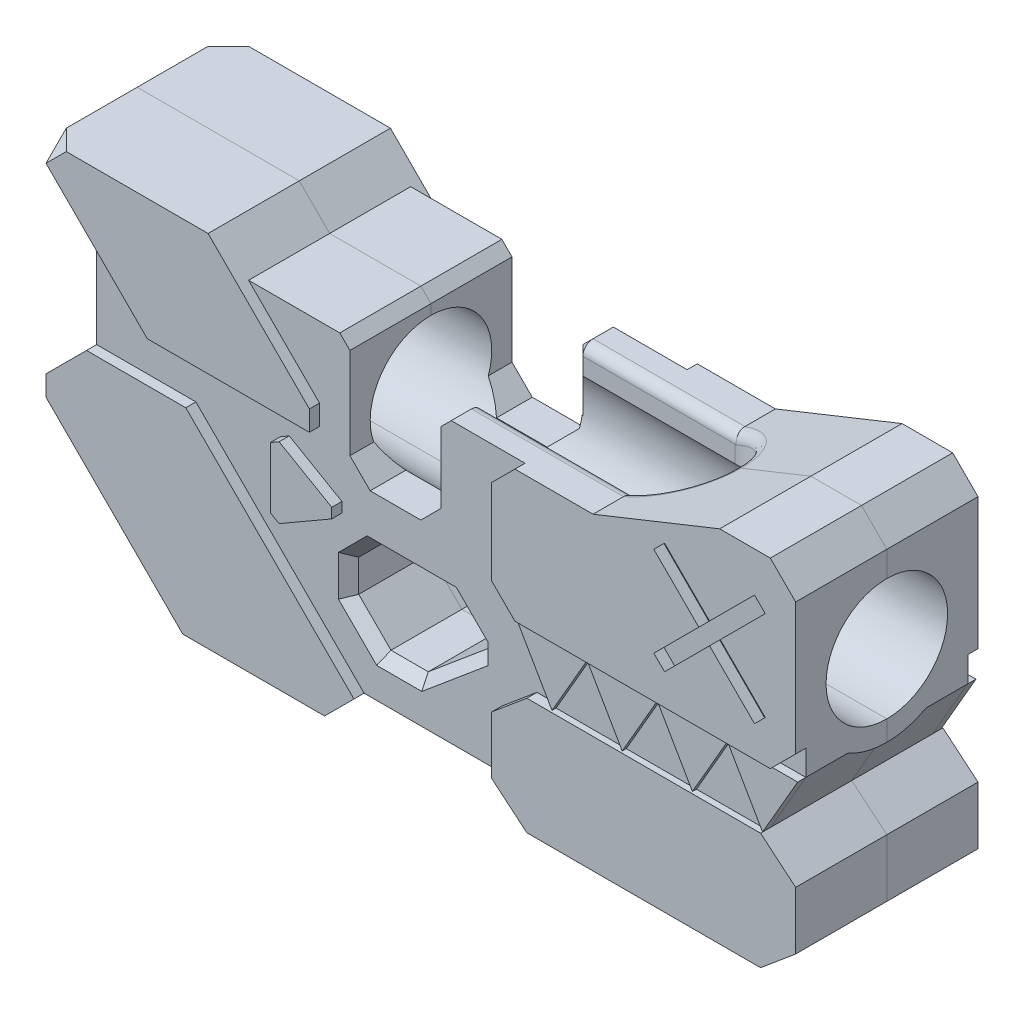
SolidWorks part; units mm, degrees
other "Left Body"
other "Right Body" parameters "D28"=1, "D29"=1, "D30"=1
ref_plane "Front Plane" through (0, 0, 0) normal (0, 0, 1) x (1, 0, 0)
ref_plane "Top Plane" through (0, 0, 0) normal (0, 1, 0) x (1, 0, 0)
ref_plane "Right Plane" through (0, 0, 0) normal (1, 0, 0) x (0, 0, -1)
sketch "Sketch1" plane through (0, 0, 0) normal (0, 0, 1) x (1, 0, 0)
  line L0 (0, -20.2192) -> (0, 20.2192) construction
  line L1 (-50.0725, 0) -> (50.0725, 0) construction
  line L2 (0, 6) -> (45, 6)
  line L3 (45, 6) -> (45, -6)
  line L4 (45, -6) -> (0, -6)
  line L5 (0, -6) -> (0, 6)
  line L6 (-25, 6) -> (0, 6)
  line L7 (-25, 6) -> (-25, -6)
  line L8 (-25, -6) -> (0, -6)
  line L9 (-20, 5.5) -> (0, 5.5)
  line L10 (-20, 5.5) -> (-20, -5.5)
  line L11 (-20, -5.5) -> (0, -5.5)
  line L12 (0, -5.5) -> (20, -5.5)
  line L13 (40, -5.5) -> (40, 5.5) construction
  line L14 (20, 5.5) -> (0, 5.5)
  line L15 (20, 5.5) -> (20, -5.5)
  line L16 (-25, 8) -> (45, 8)
  line L17 (20, 5.5) -> (40, 5.5) construction
  line L18 (-25, -8) -> (45, -8)
  line L19 (20, -5.5) -> (40, -5.5) construction
  line L22 (30, 0) -> (30, 8) construction
  line L23 (-10, 8) -> (-10, -8) construction
  line L24 (-5, 8) -> (-5, -8) construction
  line L25 (-13.5555, -24.5) -> (-1.5, -24.5) construction
  line L26 (-10.5555, -8) -> (-10.5555, -23)
  line L27 (-4.5, -8) -> (-4.5, -23)
  line L28 (-4.5, -23) -> (-10.5555, -23)
  circle A0 centre (5, 0) radius 4
  circle A1 centre (25, 0) radius 4 construction
  circle A2 centre (5, 0) radius 5
  circle A3 centre (25, 0) radius 5
  point P4 (0, 0)
  point P8 (0, 0)
  point P11 (45, 0)
  point P21 (-20, 0)
  dimension "D3" = 8
  dimension "D5" = 8
  dimension "D14" = 1
  dimension "D15" = 1
  dimension "D1" = 11
  dimension "D2" = 12
  dimension "D4" = 5
  dimension "D6" = 20
  dimension "D7" = 15
  dimension "D8" = 2
  dimension "D9" = 25
  dimension "D10" = 2
  dimension "D11" = 5
  dimension "D12" = 15
  dimension "D13" = 5
  dimension "D16" = 10
  dimension "D17" = 5
  dimension "D18" = 15
  dimension "D19" = 0.5555
  dimension "D20" = 0.5
  dimension "D21" = 1.5
  dimension "D22" = 3
  dimension "D23" = 3
sketch "Sketch2" plane through (0, 0, 0) normal (1, 0, 0) x (0, 0, -1)
  line L1 (-8, -8) -> (8, -8)
  line L2 (-8, -8) -> (-8, 8)
  line L3 (-8, 8) -> (8, 8)
  line L4 (8, -8) -> (8, 8)
  line L5 (0, 8) -> (0, -8) construction
  line L6 (-8, 0) -> (8, 0) construction
  circle A0 centre (0, 0) radius 6
  circle A1 centre (0, 0) radius 8
  dimension "D1" = 12
  dimension "D2" = 2
extrude "Boss-Extrude1" add sketch "Sketch2" against normal blind 25 contours A1 L4 L3 | A1 L3 L2 | A1 L2 L1 | A1 L1 L4 | A1 A0
sketch "Sketch3" plane through (0, 0, 0) normal (1, 0, 0) x (0, 0, -1)
  line L4 (8, 8) -> (-8, 8)
  line L5 (-8, 8) -> (-8, -8)
  line L6 (-8, -8) -> (8, -8)
  line L7 (8, -8) -> (8, 8)
  line L8 (8, 8) -> (-8, 8)
  line L9 (-8, 8) -> (-8, -8)
  line L10 (-8, -8) -> (8, -8)
  line L11 (8, -8) -> (8, 8)
  dimension "D1" = 0
extrude "Boss-Extrude2" add sketch "Sketch3" along normal blind 45 contours M8 M5 M6 M7 M9
sketch "Sketch4" plane through (0, 8, 0) normal (0, 1, 0) x (1, 0, 0)
  line L0 (-51.1534, 0) -> (51.1534, 0) construction
  line L1 (5, 5) -> (25, 5)
  line L3 (5, -5) -> (25, -5)
  circle A0 centre (5, 0) radius 5
  circle A1 centre (25, 0) radius 5
  point P12 (0, 0)
  dimension "D1" = 10
  dimension "D2" = 5
  dimension "D3" = 20
extrude "Cut-Extrude1" cut sketch "Sketch4" against normal blind 10 contours A0 L0 | L0 A0 | L0 A0 L3 A1 | A0 L0 A1 L1 | A1 L0 | L0 A1
sketch "Sketch6" plane through (0, 0, 8) normal (0, 0, 1) x (1, 0, 0)
  line L0 (0, 8) -> (5, 6)
  line L1 (-25, 8) -> (45, 8) construction
  line L2 (0, 8) -> (30, 8)
  line L3 (30, 8) -> (25, 6)
  line L6 (5, 6) -> (25, 6)
  line L9 (0, 6) -> (45, 6) construction
  line L12 (5, 0) -> (5, 10.0235) construction
  line L13 (25, 0) -> (25, 10.3915) construction
extrude "Cut-Extrude5" cut sketch "Sketch6" against normal through all contours L0 L6 L3 L2
sketch "Sketch8" plane through (0, 0, 8) normal (0, 0, 1) x (1, 0, 0)
  line L0 (0, 0) -> (0, 8)
  line L1 (9, 0) -> (9, 6)
  line L2 (0, 6) -> (45, 6) construction
  line L3 (9, 6) -> (0, 8)
  line L5 (0, -6) -> (0, 6) construction
  line L6 (-50.0725, 0) -> (50.0725, 0) construction
  line L7 (0, 0) -> (0, -4)
  line L8 (0, -4) -> (9, -4)
  line L9 (9, -4) -> (9, 0)
  circle A0 centre (5, 0) radius 5 construction
  circle A1 centre (5, 0) radius 4 construction
extrude "Cut-Extrude7" cut sketch "Sketch8" against normal blind 8
chamfer "Chamfer2" distance 2 angle 45 2 edges at (9, -4, 6.2361) (0, -4, 6.2361)
chamfer "Chamfer1" distance 1 angle 45 1 edges at (9, 6, 6.5)
sketch "Sketch9" plane through (0, 0, 8) normal (0, 0, 1) x (1, 0, 0)
  line L0 (45, 8.5) -> (45, -7)
  line L2 (-25, -8) -> (-25, 8)
  line L6 (0, 6) -> (45, 6) construction
  line L9 (-25, 8) -> (-28, 8)
  line L10 (-28, 8) -> (-28, -8)
  line L11 (-28, -8) -> (-25, -8)
  line L12 (-29, 9) -> (-25, 5)
  line L13 (-25, 5) -> (-25, -5)
  line L14 (-25, -5) -> (-29, -9)
  line L15 (-29, 9) -> (-29, 11)
  line L16 (-29, 11) -> (-13, 11)
  line L17 (-13, 11) -> (-3, 1)
  line L18 (-3, 1) -> (-3, -1)
  line L19 (-3, -1) -> (-19, -1)
  line L20 (-19, -1) -> (-25, 5)
  line L21 (-29, -9) -> (-29, -11)
  line L22 (-29, -11) -> (-15.5, -24.5)
  line L23 (-15.5, -24.5) -> (-1.5, -24.5)
  line L24 (-13.5555, -24.5) -> (-1.5, -24.5) construction
  line L25 (-25, -5) -> (-15.201, -5)
  line L26 (-15.201, -5) -> (1.3995, -21.6005)
  line L27 (1.3995, -21.6005) -> (-1.5, -24.5)
  line L28 (1.6985, -8) -> (10.509, -8)
  line L29 (-25, -8) -> (45, -8) construction
  line L30 (10.509, -8) -> (13.6371, -11.1281)
  line L31 (13.6371, -13.1281) -> (7.099, -18.6005)
  line L32 (7.099, -18.6005) -> (2.6421, -18.6005)
  line L33 (2.6421, -18.6005) -> (-1.1299, -14.8284)
  line L34 (-1.1299, -14.8284) -> (-1.1299, -10.8284)
  line L35 (-1.1299, -10.8284) -> (1.6985, -8)
  line L36 (17.2872, 6) -> (15, 3.7128)
  line L37 (15, 3.7128) -> (15, -4.7128)
  line L38 (15, -4.7128) -> (17.2872, -7)
  line L39 (17.2872, -7) -> (45, -7)
  line L40 (42.5, -7) -> (45, -4.5)
  line L42 (45, 8.5) -> (42.5, 11)
  line L43 (42.5, 11) -> (37.5, 11)
  line L45 (18.4641, -13) -> (15, -15.8995)
  line L46 (15, -15.8995) -> (15, -21.6005)
  line L47 (15, -21.6005) -> (18.4641, -24.5)
  line L48 (18.4641, -24.5) -> (41.5359, -24.5)
  line L49 (41.5359, -24.5) -> (45, -21.6005)
  line L50 (45, -21.6005) -> (45, -15.8995)
  line L51 (45, -15.8995) -> (41.5359, -13)
  line L52 (41.5359, -13) -> (18.4641, -13)
  line L53 (1.3995, -21.6005) -> (15, -21.6005)
  line L59 (-6.8554, -3.8) -> (-5.9894, -3.3)
  line L61 (45, -7) -> (41.5359, -13)
  line L62 (38.0718, -7) -> (41.5359, -13)
  line L63 (45, 8) -> (45, -8) construction
  line L64 (34.6077, -13) -> (31.1436, -7)
  line L76 (38.0718, -7) -> (34.6077, -13)
  line L77 (31.1436, -7) -> (27.6795, -13)
  line L78 (27.6795, -13) -> (24.2154, -7)
  line L79 (24.2154, -7) -> (20.7513, -13)
  line L80 (20.7513, -13) -> (17.2872, -7)
  line L81 (15, -15.8995) -> (45, -15.8995) construction
  line L82 (41.5359, -13) -> (41.5359, -24.5) construction
  line L84 (13.6371, -11.1281) -> (13.6371, -13.1281)
  line L85 (-6.8554, -2.8) -> (-6.8554, -10.8)
  line L86 (-6.8554, -10.8) -> (0.0728, -6.8)
  line L87 (0.0728, -6.8) -> (-6.8554, -2.8)
  line L88 (25, 6) -> (37.5, 11)
  line L89 (-6.8554, -9.8) -> (-5.9894, -10.3)
  line L90 (-25, 8) -> (45, 8) construction
  line L91 (30, 8) -> (25, 6) construction
  line L92 (-0.7932, -7.3) -> (-0.7932, -6.3)
  line L93 (17.2872, 6) -> (25, 6)
  line L94 (31, 6) -> (40.9393, -3.9393)
  line L95 (31, 7.0607) -> (42, 7.0607)
  line L96 (31, 7.0607) -> (31, -3.9393)
  line L97 (31, -3.9393) -> (42, -3.9393)
  line L98 (42, 7.0607) -> (42, -3.9393)
  line L99 (36.5, -3.9393) -> (36.5, 7.0607) construction
  line L100 (31, 1.5607) -> (42, 1.5607) construction
  line L101 (40.9393, -3.9393) -> (42, -2.8787)
  line L102 (42, -2.8787) -> (32.0607, 7.0607)
  line L103 (32.0607, 7.0607) -> (31, 6)
  line L104 (31, -2.8787) -> (32.0607, -3.9393)
  line L105 (32.0607, -3.9393) -> (42, 6)
  line L106 (42, 6) -> (40.9393, 7.0607)
  line L107 (40.9393, 7.0607) -> (31, -2.8787)
  point P2 (36.5, 1.5607)
  dimension "D1" = 3
  dimension "D2" = 135
  dimension "D3" = 2
  dimension "D4" = 2
  dimension "D5" = 16
  dimension "D6" = 14
  dimension "D7" = 4
  dimension "D8" = 12
  dimension "D9" = 14
  dimension "D10" = 60
  dimension "D11" = 60
  dimension "D12" = 15
  dimension "D13" = 30
  dimension "D14" = 11.5
  dimension "D15" = 3
  dimension "D16" = 3
  dimension "D17" = 3
  dimension "D18" = 5.5
  dimension "D19" = 135
  dimension "D20" = 4
  dimension "D21" = 4
  dimension "D22" = 2
  dimension "D23" = 1.8
  dimension "D24" = 1.8
  dimension "D25" = 8
  dimension "D26" = 1
  dimension "D27" = 1
  dimension "D28" = 1
  dimension "D29" = 1
  dimension "D30" = 2.5
  dimension "D31" = 2.5
  dimension "D32" = 2.5
  dimension "D33" = 11
  dimension "D34" = 1.5
  dimension "D35" = 1.5
  dimension "D36" = 3
  dimension "D37" = 2.5
sketch "Sketch10" plane through (0, 0, 8) normal (0, 0, 1) x (1, 0, 0)
  line L0 (-29, 11) -> (-29, 9)
  line L1 (-29, 9) -> (-25, 5)
  line L2 (-25, 5) -> (-25, -5)
  line L3 (-25, -5) -> (-29, -9)
  line L4 (-29, -9) -> (-29, -11)
  line L5 (-29, -11) -> (-15.5, -24.5)
  line L6 (-15.5, -24.5) -> (-1.5, -24.5)
  line L7 (-1.5, -24.5) -> (1.3995, -21.6005)
  line L8 (1.3995, -21.6005) -> (15, -21.6005)
  line L9 (15, -21.6005) -> (18.4641, -24.5)
  line L10 (18.4641, -24.5) -> (41.5359, -24.5)
  line L11 (41.5359, -24.5) -> (45, -21.6005)
  line L12 (45, -21.6005) -> (45, -15.8995)
  line L13 (45, -15.8995) -> (41.5359, -13)
  line L14 (41.5359, -13) -> (45, -7)
  line L15 (45, -7) -> (45, 8.5)
  line L16 (45, 8.5) -> (42.5, 11)
  line L17 (42.5, 11) -> (37.5, 11)
  line L18 (37.5, 11) -> (25, 6)
  line L19 (25, 6) -> (5, 6)
  line L20 (5, 6) -> (0, 8)
  line L21 (0, 8) -> (-10, 8)
  line L22 (-10, 8) -> (-13, 11)
  line L23 (-13, 11) -> (-29, 11)
  line L24 (1.6985, -8) -> (-1.1299, -10.8284)
  line L25 (-1.1299, -10.8284) -> (-1.1299, -14.8284)
  line L26 (-1.1299, -14.8284) -> (2.6421, -18.6005)
  line L27 (2.6421, -18.6005) -> (7.099, -18.6005)
  line L28 (7.099, -18.6005) -> (13.6371, -13.1281)
  line L29 (13.6371, -13.1281) -> (13.6371, -11.1281)
  line L30 (13.6371, -11.1281) -> (10.509, -8)
  line L31 (10.509, -8) -> (1.6985, -8)
  line L32 (10.0948, -9) -> (2.1127, -9)
  line L33 (2.1127, -9) -> (-0.1299, -11.2426)
  line L34 (-0.1299, -11.2426) -> (-0.1299, -14.4142)
  line L35 (-0.1299, -14.4142) -> (3.0563, -17.6005)
  line L36 (3.0563, -17.6005) -> (6.7358, -17.6005)
  line L37 (6.7358, -17.6005) -> (12.6371, -12.661)
  line L38 (12.6371, -12.661) -> (12.6371, -11.5423)
  line L39 (12.6371, -11.5423) -> (10.0948, -9)
  dimension "D1" = 1
extrude "Boss-Extrude3" add sketch "Sketch10" against normal blind 16 contours L30 L29 L28 L27 L26 L25 L24 L3 L4 L5 L6 L7 L8 L9 L10 L11 L12 L13 L14 M10 M9 | L14 M10 M11 M12 M13 M1 M2 M3 M4 M5 M6 M7 M8 M9 | L22 L23 L0 L1 M9 M8 | L17 L18 L15 L16 M12 | L29 L30 L24 L25 L26 L27 L28 L39 L38 L37 L36 L35 L34 L33 L32 M10 | L19 L20 M7 M6 M5 M4 M3 M2
chamfer "Chamfer3" distance 1 angle 45 16 edges at (11.3659, -10.2711, 8) (11.3659, -10.2711, -8) (12.6371, -12.1017, 8) (12.6371, -12.1017, -8) (9.6864, -15.1308, 8) (9.6864, -15.1308, -8) (4.8961, -17.6005, 8) (4.8961, -17.6005, -8) (1.4632, -16.0074, 8) (1.4632, -16.0074, -8) (-0.1299, -12.8284, 8) (-0.1299, -12.8284, -8) (0.9914, -10.1213, 8) (0.9914, -10.1213, -8) (6.1037, -9, 8) (6.1037, -9, -8)
sketch "Sketch11" plane through (45, 0, 0) normal (1, 0, 0) x (0, 0, -1)
  line L0 (0, 6) -> (0, -6) construction
  circle A0 centre (0, 0) radius 6
  dimension "D1" = 12
sketch "Sketch12" plane through (0, 0, 8) normal (0, 0, 1) x (1, 0, 0)
  line L0 (45, -7) -> (44.4226, -8)
  line L1 (44.4226, -8) -> (45, -8)
  line L2 (45, -8) -> (45, -7)
extrude "Cut-Extrude9" cut sketch "Sketch12" against normal through all
sketch "Sketch13" plane through (45, 0, 0) normal (1, 0, 0) x (0, 0, -1)
  line L0 (8, -7) -> (-8, -7) construction
  line L1 (8, -7) -> (-8, -7)
  arc A0 (-3.873, -7) -> (3.873, -7) centre (0, 0) ccw
extrude "Boss-Extrude4" add sketch "Sketch13" against normal up to next contours L1 A0
sketch "Sketch14" plane through (0, 8, 0) normal (0, 1, 0) x (1, 0, 0)
  line L0 (5, -5) -> (25, -5) construction
  line L1 (5, 5) -> (25, 5) construction
  line L2 (5, -5) -> (25, -5)
  line L3 (5, 5) -> (25, 5)
  circle A0 centre (25, 0) radius 5 construction
  circle A1 centre (5, 0) radius 5 construction
  arc A2 (25, -5) -> (25, 5) centre (25, 0) ccw
  arc A3 (5, 5) -> (5, -5) centre (5, 0) ccw
extrude "Cut-Extrude10" cut sketch "Sketch14" against normal blind 9
sketch "Sketch15" plane through (0, 0, 8) normal (0, 0, 1) x (1, 0, 0)
  line L1 (9, 6) -> (0, 8) construction
  line L2 (9, 0) -> (9, 6) construction
  line L3 (9, -4) -> (9, 0) construction
  line L4 (0, -6) -> (0, 6) construction
  line L5 (0, -4) -> (9, -4) construction
  line L7 (9, 6) -> (0, 8)
  line L8 (9, 0) -> (9, 6)
  line L9 (9, -4) -> (9, 0)
  line L10 (0, -4) -> (0, 6)
  line L11 (0, -4) -> (9, -4)
  line L12 (0, -4) -> (0, 8)
extrude "Cut-Extrude11" cut sketch "Sketch15" against normal through all contours L12 L10 L11 L9 L8 M14 M15
chamfer "Chamfer4" distance 2 angle 45 2 edges at (9, -4, 0) (0, -4, 0)
fillet "Fillet1" radius 1 3 edges at (17, 6, 5) (30, 8, 0) (17, 6, -5)
chamfer "Chamfer5" distance 1 angle 45 6 edges at (0, 8, 0) (9, 2, -5) (9, 5.7071, -5.2929) (9, 6, 7) (9, 2, 5) (9, 5.7071, 5.2929)
sketch "Sketch16" plane through (0, 0, 8) normal (0, 0, 1) x (1, 0, 0)
  line L0 (-29, 11) -> (-13, 11)
  line L1 (-13, 11) -> (-3, 1)
  line L2 (-3, 1) -> (-3, -1)
  line L3 (-3, -1) -> (-19, -1)
  line L4 (-19, -1) -> (-29, 9)
  line L5 (-29, 9) -> (-29, 11)
  line L6 (-25, -5) -> (-29, -9)
  line L7 (-29, -9) -> (-29, -11)
  line L8 (-29, -11) -> (-15.5, -24.5)
  line L9 (-15.5, -24.5) -> (-1.5, -24.5)
  line L10 (-1.5, -24.5) -> (1.3995, -21.6005)
  line L11 (1.3995, -21.6005) -> (-15.201, -5)
  line L12 (-15.201, -5) -> (-25, -5)
  line L13 (15, -15.8995) -> (18.4641, -13)
  line L14 (18.4641, -13) -> (41.5359, -13)
  line L15 (41.5359, -13) -> (45, -15.8995)
  line L16 (45, -15.8995) -> (45, -21.6005)
  line L17 (45, -21.6005) -> (41.5359, -24.5)
  line L18 (41.5359, -24.5) -> (18.4641, -24.5)
  line L19 (18.4641, -24.5) -> (15, -21.6005)
  line L20 (15, -21.6005) -> (15, -15.8995)
  line L37 (17.2872, 6) -> (15, 3.7128)
  line L38 (15, 3.7128) -> (15, -4.7128)
  line L39 (15, -4.7128) -> (17.2872, -7)
  line L40 (17.2872, -7) -> (42.5, -7)
  line L41 (45, -4.5) -> (45, 8.5)
  line L42 (45, 8.5) -> (42.5, 11)
  line L43 (42.5, 11) -> (37.5, 11)
  line L44 (37.5, 11) -> (25, 6)
  line L45 (25, 6) -> (17.2872, 6)
  line L46 (42.5, -7) -> (45, -4.5)
extrude "Boss-Extrude8" add sketch "Sketch16" along normal blind 1
sketch "Sketch18" plane through (0, 0, 8) normal (0, 0, 1) x (1, 0, 0)
  line L0 (17.2872, -7) -> (20.7513, -13)
  line L1 (20.7513, -13) -> (24.2154, -7)
  line L2 (24.2154, -7) -> (17.2872, -7)
  line L3 (24.2154, -7) -> (27.6795, -13)
  line L4 (27.6795, -13) -> (31.1436, -7)
  line L5 (17.2872, -7) -> (45, -7) construction
  line L6 (31.1436, -7) -> (24.2154, -7)
  line L7 (34.6077, -13) -> (38.0718, -7)
  line L8 (38.0718, -7) -> (31.1436, -7)
  line L9 (31.1436, -7) -> (34.6077, -13)
  line L10 (38.0718, -7) -> (41.5359, -13)
  line L11 (41.5359, -13) -> (45, -7)
  line L12 (45, -7) -> (38.0718, -7)
extrude "Boss-Extrude13" add sketch "Sketch18" along normal blind 0.8 separate body contours L0 L1 M10 | L3 L4 M10 | L9 L7 M10 | L12 L10 M34 M10
sketch "Sketch19" plane through (0, 0, 8) normal (0, 0, 1) x (1, 0, 0)
  line L0 (-0.7932, -7.3) -> (-0.7932, -6.3) construction
  line L1 (-6.8554, -3.8) -> (-5.9894, -3.3) construction
  line L2 (-6.8554, -9.8) -> (-5.9894, -10.3) construction
  line L3 (-6.8554, -10.8) -> (0.0728, -6.8) construction
  line L4 (0.0728, -6.8) -> (-6.8554, -2.8) construction
  line L5 (-6.8554, -2.8) -> (-6.8554, -10.8) construction
  line L6 (-0.7932, -7.3) -> (-0.7932, -6.3)
  line L7 (-6.8554, -3.8) -> (-5.9894, -3.3)
  line L8 (-6.8554, -9.8) -> (-5.9894, -10.3)
  line L9 (-5.9894, -10.3) -> (-0.7932, -7.3)
  line L10 (-0.7932, -6.3) -> (-5.9894, -3.3)
  line L11 (-6.8554, -3.8) -> (-6.8554, -9.8)
extrude "Boss-Extrude14" add sketch "Sketch19" along normal blind 1
sketch "Sketch20" plane through (0, 0, 9) normal (0, 0, 1) x (1, 0, 0)
  line L0 (42, 6) -> (40.9393, 7.0607) construction
  line L1 (40.9393, -3.9393) -> (42, -2.8787) construction
  line L2 (31, -2.8787) -> (32.0607, -3.9393) construction
  line L3 (42, -2.8787) -> (32.0607, 7.0607) construction
  line L4 (32.0607, -3.9393) -> (42, 6) construction
  line L5 (40.9393, 7.0607) -> (31, -2.8787) construction
  line L6 (31, 6) -> (40.9393, -3.9393) construction
  line L7 (32.0607, 7.0607) -> (31, 6) construction
  line L8 (42, 6) -> (40.9393, 7.0607)
  line L9 (40.9393, -3.9393) -> (42, -2.8787)
  line L10 (31, -2.8787) -> (32.0607, -3.9393)
  line L11 (42, -2.8787) -> (37.5607, 1.5607)
  line L12 (32.0607, -3.9393) -> (36.5, 0.5)
  line L13 (40.9393, 7.0607) -> (36.5, 2.6213)
  line L14 (31, 6) -> (35.4393, 1.5607)
  line L15 (32.0607, 7.0607) -> (31, 6)
  line L16 (35.4393, 1.5607) -> (31, -2.8787)
  line L17 (37.5607, 1.5607) -> (42, 6)
  line L18 (36.5, 2.6213) -> (32.0607, 7.0607)
  line L19 (36.5, 0.5) -> (40.9393, -3.9393)
extrude "Cut-Extrude12" cut sketch "Sketch20" against normal blind 1
other "SurfaceCut1"
sketch "Sketch24" plane through (0, 0, 8) normal (0, 0, 1) x (1, 0, 0)
  line L0 (24.2154, -7) -> (20.7513, -13)
  line L1 (20.7513, -13) -> (27.6795, -13)
  line L2 (18.4641, -13) -> (41.5359, -13) construction
  line L3 (27.6795, -13) -> (31.1436, -7) construction
  line L4 (27.6795, -13) -> (24.2154, -7)
  line L5 (27.6795, -13) -> (31.1436, -7)
  line L6 (31.1436, -7) -> (34.6077, -13)
  line L7 (34.6077, -13) -> (38.0718, -7) construction
  line L8 (18.4641, -13) -> (41.5359, -13) construction
  line L9 (34.6077, -13) -> (27.6795, -13)
  line L10 (34.6077, -13) -> (38.0718, -7)
  line L11 (38.0718, -7) -> (41.5359, -13)
  line L12 (41.5359, -13) -> (34.6077, -13)
extrude "Boss-Extrude15" add sketch "Sketch24" along normal blind 0.4 contours L4 L0 M25 | L6 L5 M25 | L11 L10 M25
sketch "Sketch26" plane through (-29, 0, 0) normal (-1, 0, 0) x (0, 0, 1)
  line L0 (9, 9) -> (7, 11)
  line L1 (0, 11) -> (9, 11) construction
  dimension "D1" = 2
sketch "Sketch27" plane through (0, 0, 9) normal (0, 0, 1) x (1, 0, 0)
  line L0 (-29, 9) -> (-27, 11)
  line L1 (-13, 11) -> (-29, 11) construction
  line L2 (-29, 9) -> (-29, 11) construction
  dimension "D1" = 2
ref_plane "Plane1" through (-15.6667, 15.6667, 15.6667) normal (0.5774, -0.5774, -0.5774) x (-0.8165, -0.4082, -0.4082)
other "SurfaceCut2"
mirror "Mirror1" about plane through (0, 0, 0) normal (0, 0, 1)
sketch "Sketch22" plane through (0, -24.5, 0) normal (0, -1, 0) x (1, 0, 0)
  line L2 (-10.5555, 0) -> (-4.5, 0) construction
  line L3 (-7.5278, -2.2181) -> (-7.5278, 2.2181) construction
  circle A1 centre (-7.5278, 0) radius 3.65
  point P5 (-7.5278, 0)
  point P7 (-10.5555, 0)
  point P9 (-4.5, 0)
  dimension "D1" = 7.3
extrude "Bottom Magnet Hole" cut sketch "Sketch22" against normal blind 16.5
sketch "Sketch23" plane through (0, -24.5, 0) normal (0, -1, 0) x (1, 0, 0)
  line L0 (-13.5555, 0) -> (-1.5, 0) construction
  circle A0 centre (-7.5278, 0) radius 5.65
  arc A1 (-3.8778, 0) -> (-11.1778, 0) centre (-7.5278, 0) ccw construction
  dimension "D1" = 2
  dimension "D2" = 11.3
extrude "Bottom Cap Hole" cut sketch "Sketch23" against normal blind 2
extrude "Cut-Extrude17" cut sketch "Sketch11" against normal through all contours A0
